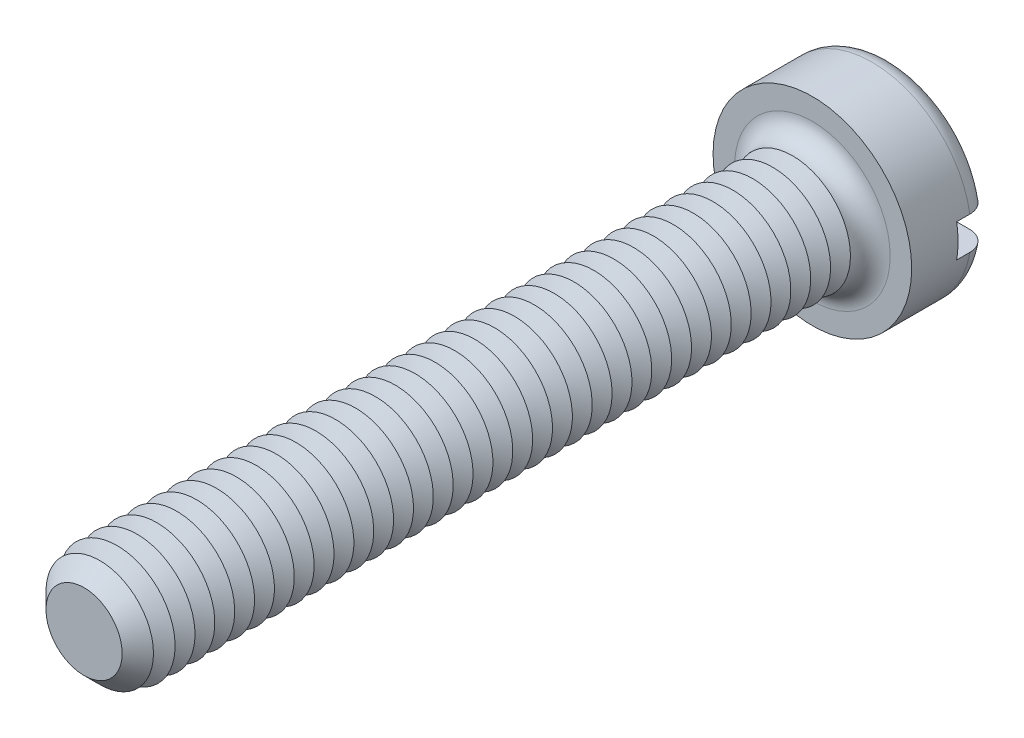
SolidWorks part; units mm, degrees
ref_plane "Front Plane" through (0, 0, 0) normal (0, 0, 1) x (1, 0, 0)
ref_plane "Top Plane" through (0, 0, 0) normal (0, 1, 0) x (1, 0, 0)
ref_plane "Right Plane" through (0, 0, 0) normal (1, 0, 0) x (0, 0, -1)
sketch "Sketch3" plane through (0, 0, 0) normal (0, 0, 1) x (1, 0, 0)
  circle A0 centre (0, 0) radius 3
  dimension "D1" = 6
extrude "Boss-Extrude2" add sketch "Sketch3" against normal blind 2.4
sketch "Sketch4" plane through (0, 0, 0) normal (0, 0, 1) x (1, 0, 0)
  circle A0 centre (0, 0) radius 1.75
  dimension "D1" = 3.5
extrude "Boss-Extrude3" add sketch "Sketch4" along normal blind 22
fillet "Fillet1" radius 0.6 2 edges at (3, 0, -2.4) (1.75, 0, 0)
chamfer "Chamfer1" distance 0.6 angle 45 1 edges at (1.75, 0, 22)
sketch "Sketch5" plane through (0, 0, 0) normal (1, 0, 0) x (0, 0, -1)
  line L0 (1.6944, 0) -> (-7.6738, 0) construction
sketch "Sketch6" plane through (0, 0, 0) normal (1, 0, 0) x (0, 0, -1)
  line L0 (-0.6, 1.75) -> (-0.9, 1.2304)
  line L1 (-0.9, 1.2304) -> (-1.2, 1.75)
  line L2 (-0.6, 1.75) -> (-21.4, 1.75) construction
  line L3 (-1.2, 1.75) -> (-0.6, 1.75)
  dimension "D1" = 0.6
revolve "Cut-Revolve1" cut sketch "Sketch6" angle 360 about L0
pattern_linear "LPattern1" count 35 spacing 0.6 along (0, 0, 1) of "Cut-Revolve1"
sketch "Sketch8" plane through (0, 0, -2.4) normal (0, 0, -1) x (-1, 0, 0)
  line L1 (3, -0.5) -> (-3, -0.5)
  line L2 (3, -0.5) -> (3, 0.5)
  line L3 (3, 0.5) -> (-3, 0.5)
  line L4 (-3, -0.5) -> (-3, 0.5)
  line L5 (3, -0.5) -> (-3, 0.5) construction
  line L6 (3, 0.5) -> (-3, -0.5) construction
  point P0 (0, 0)
  dimension "D1" = 6
  dimension "D2" = 1
extrude "Cut-Extrude1" cut sketch "Sketch8" against normal blind 1
